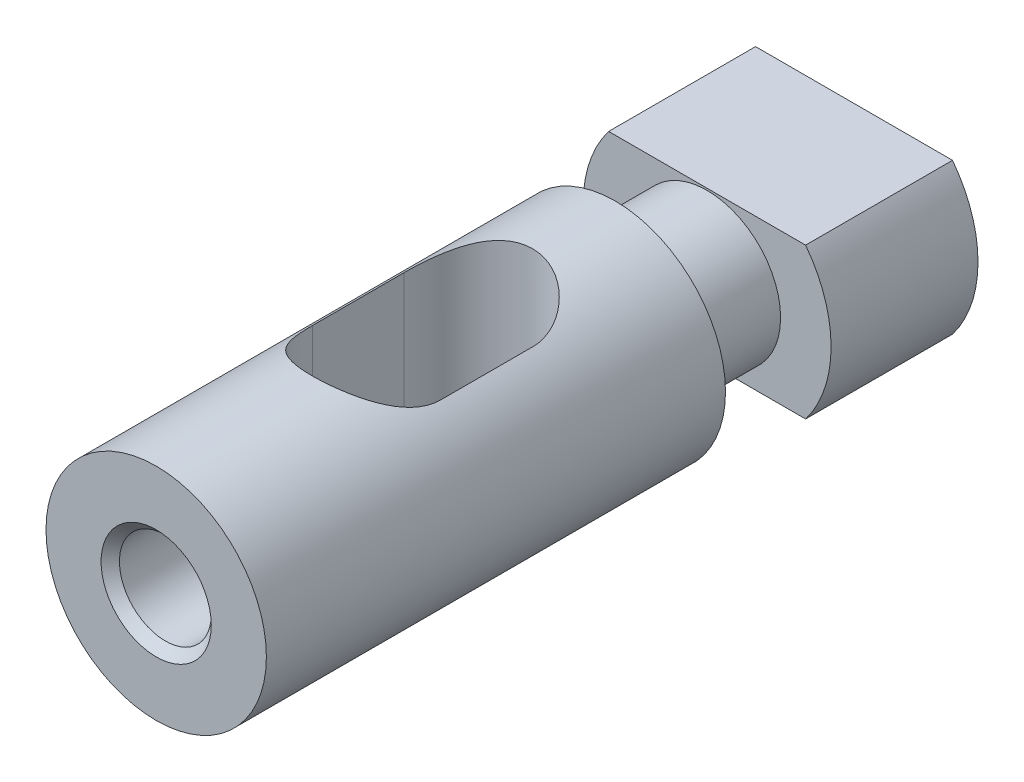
SolidWorks part; units mm, degrees
ref_plane "Front" through (0, 0, 0) normal (0, 0, 1) x (1, 0, 0)
ref_plane "Top" through (0, 0, 0) normal (0, 1, 0) x (1, 0, 0)
ref_plane "Right" through (0, 0, 0) normal (1, 0, 0) x (0, 0, -1)
imported_body "Imported1"
sketch "Sketch1" plane through (0, 0, 13.18) normal (0, 0, 1) x (1, 0, 0)
  point P0 (0, -13)
hole_wizard "M6x1.0 Tapped Hole1" positions "3DSketch1" profile "Sketch2" tap size "M6x1.0" standard "Ansi Metric"
sketch3d "3DSketch1"
  point P0 (0, -13, 13.18)
sketch "Sketch2" plane through (0, -13, 13.18) normal (1, 0, 0) x (0, -1, 0)
  line L0 (0, 0) -> (0, 16.5022)
  line L1 (0, 16.5022) -> (2.5, 15)
  line L2 (2.5, 15) -> (2.5, 0)
  line L5 (2.5, 0) -> (0, 0)
  line L10 (0, 16.5022) -> (-2.5, 15) construction
  line L11 (0, -6.35) -> (0, 107.95) construction
  dimension "Tap Drill Dia." = 5
  dimension "Tap Drill Depth" = 15
  dimension "Drill Angle" = 118
